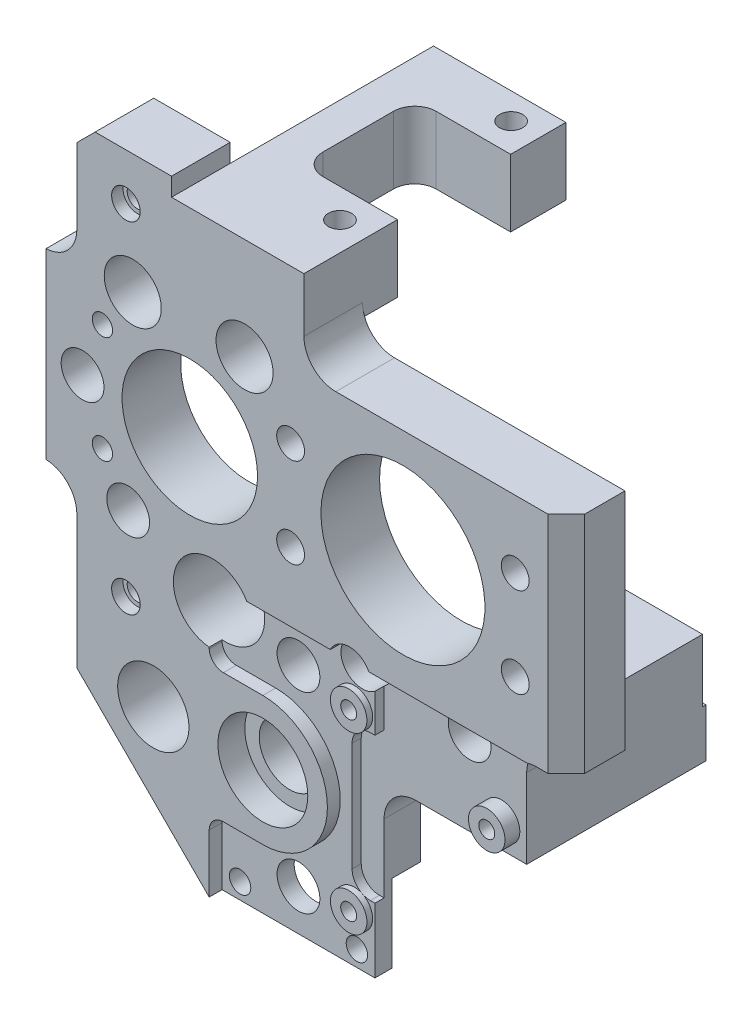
SolidWorks part; units mm, degrees
ref_plane "Front" through (0, 0, 0) normal (0, 0, 1) x (1, 0, 0)
ref_plane "Top" through (0, 0, 0) normal (0, 1, 0) x (1, 0, 0)
ref_plane "Right" through (0, 0, 0) normal (1, 0, 0) x (0, 0, -1)
sketch "Sketch1" plane through (0, 0, 0) normal (0, 0, 1) x (1, 0, 0)
  line L1 (-25.4, 24.13) -> (32.512, 24.13)
  line L2 (-25.4, 24.13) -> (-25.4, -43.274)
  line L3 (-25.4, -43.274) -> (32.512, -43.274)
  line L4 (32.512, 24.13) -> (32.512, -43.274)
  dimension "D1" = 24.13
  dimension "D2" = 67.404
  dimension "D3" = 25.4
  dimension "D4" = 57.912
extrude "Extrude1" add sketch "Sketch1" along normal blind 6.5278
sketch "Sketch2" plane through (0, 0, 6.5278) normal (0, 0, 1) x (1, 0, 0)
  circle A0 centre (-16.51, 18.9414) radius 1
  dimension "D1" = 16.51
  dimension "D2" = 2
  dimension "D3" = 18.9414
extrude "Cut-Extrude1" [suppressed] cut sketch "Sketch2" against normal through all
mirror "Mirror1" [suppressed] about plane through (0, 0, 0) normal (0, 1, 0)
sketch "Sketch3" plane through (0, 0, 0) normal (0, 0, -1) x (-1, 0, 0)
  line L1 (-32.512, -12.5) -> (-25.654, -12.5)
  line L2 (-32.512, -12.5) -> (-32.512, -43.274)
  line L3 (-32.512, -43.274) -> (-9.779, -43.274)
  line L4 (-25.654, -12.5) -> (-25.654, -24.892)
  line L5 (25.4, -43.274) -> (-32.512, -43.274) construction
  line L7 (-25.654, -24.892) -> (-9.779, -24.892)
  line L8 (-9.779, -24.892) -> (-9.779, -43.274)
  dimension "D1" = 9.779
  dimension "D2" = 25.654
  dimension "D3" = 24.892
  dimension "D4" = 22.733
  dimension "D5" = 30.774
extrude "Cut-Extrude2" cut sketch "Sketch3" against normal through all
sketch "Sketch4" plane through (0, 0, 0) normal (0, 0, -1) x (-1, 0, 0)
  line L0 (-9.779, -24.892) -> (-25.654, -24.892) construction
  line L1 (-25.654, -24.892) -> (-15.113, -24.892)
  line L2 (-25.654, -24.892) -> (-25.654, -12.5)
  line L3 (-25.654, -12.5) -> (-15.113, -12.5)
  line L4 (-15.113, -24.892) -> (-15.113, -12.5)
  line L5 (-25.654, -24.892) -> (-25.654, -12.5) construction
  line L6 (-25.654, -12.5) -> (-32.512, -12.5) construction
  dimension "D1" = 10.541
extrude "Extrude2" add sketch "Sketch4" along normal blind 15.492
sketch "Sketch5" plane through (0, 0, 0) normal (0, 0, 1) x (1, 0, 0)
  line L1 (32.512, 24.13) -> (3.302, 24.13)
  line L2 (32.512, 24.13) -> (32.512, 22.098)
  line L3 (32.512, 22.098) -> (3.302, 22.098)
  line L4 (3.302, 24.13) -> (3.302, 22.098)
  dimension "D1" = 2.032
  dimension "D2" = 29.21
extrude "Cut-Extrude3" cut sketch "Sketch5" along normal through all
hole_wizard "M8x0.75 Tapped Hole1" positions "Sketch9" profile "Sketch8" tap size "M8x1.25" standard "Ansi Metric"
sketch "Sketch9" plane through (0, 0, 6.5278) normal (0, 0, 1) x (1, 0, 0)
  line L0 (-25.4, 24.13) -> (-25.4, -43.274) construction
  point P0 (-1.27, -28.034)
  dimension "D1" = 24.13
  dimension "D2" = 28.034
sketch "Sketch8" plane through (-1.27, -28.034, 6.5278) normal (1, 0, 0) x (0, -1, 0)
  line L0 (0, 0) -> (0, 22.0198)
  line L1 (0, 22.0198) -> (3.4, 22.0198)
  line L2 (3.4, 22.0198) -> (3.4, 0)
  line L5 (3.4, 0) -> (0, 0)
  line L11 (0, -6.35) -> (0, 107.95) construction
  dimension "Thru Tap Drill Dia." = 6.8
  dimension "Thru Tap Drill Depth" = 22.0198
sketch "Sketch11" plane through (0, 0, 6.5278) normal (0, 0, 1) x (1, 0, 0)
  circle A0 centre (-1.27, -28.034) radius 5.0038
  circle A1 centre (-1.27, -28.034) radius 3.4 construction
  dimension "D1" = 10.0076
extrude "Cut-Extrude5" cut sketch "Sketch11" against normal blind 2.9972
sketch "Sketch12" plane through (0, 0, 0) normal (0, 0, -1) x (-1, 0, 0)
  line L1 (-32.512, 22.098) -> (-3.302, 22.098)
  line L2 (-32.512, 22.098) -> (-32.512, 12.5)
  line L3 (-32.512, 12.5) -> (-3.302, 12.5)
  line L4 (-3.302, 22.098) -> (-3.302, 12.5)
  line L5 (-3.302, 24.13) -> (-3.302, 22.098) construction
  dimension "D1" = 9.598
extrude "Cut-Extrude6" cut sketch "Sketch12" against normal through all
sketch "Sketch13" plane through (0, 0, 0) normal (0, 0, -1) x (-1, 0, 0)
  line L0 (-3.302, 24.13) -> (25.4, 24.13) construction
  line L1 (6.35, 24.13) -> (11.43, 24.13)
  line L2 (6.35, 24.13) -> (6.35, 14.605)
  line L3 (6.35, 14.605) -> (11.43, 14.605)
  line L4 (11.43, 24.13) -> (11.43, 14.605)
  line L5 (25.4, 24.13) -> (25.4, -43.274) construction
  dimension "D1" = 13.97
  dimension "D2" = 9.525
  dimension "D3" = 5.08
extrude "Extrude3" add sketch "Sketch13" along normal blind 22.6314
sketch "Sketch14" plane through (-6.35, 0, 0) normal (1, 0, 0) x (0, 0, -1)
  line L1 (0, 14.605) -> (3.8862, 14.605)
  line L2 (0, 14.605) -> (0, 22.098)
  line L3 (0, 22.098) -> (3.8862, 22.098)
  line L4 (3.8862, 14.605) -> (3.8862, 22.098)
  dimension "D1" = 3.8862
  dimension "D2" = 7.493
extrude "Extrude4" add sketch "Sketch14" along normal up to surface (9.652 mm away)
sketch "Sketch15" plane through (-6.35, 0, 0) normal (1, 0, 0) x (0, 0, -1)
  line L1 (22.6314, 14.605) -> (16.4846, 14.605)
  line L2 (22.6314, 14.605) -> (22.6314, 22.098)
  line L3 (22.6314, 22.098) -> (16.4846, 22.098)
  line L4 (16.4846, 14.605) -> (16.4846, 22.098)
  dimension "D1" = 6.1468
  dimension "D2" = 7.493
extrude "Extrude5" add sketch "Sketch15" along normal up to surface (9.652 mm away)
fillet "Fillet1" radius 2.54 2 edges at (-6.35, 18.3515, -3.8862) (-6.35, 18.3515, -16.4846)
sketch "Sketch16" plane through (0, 24.13, 0) normal (0, 1, 0) x (-1, 0, 0)
  line L1 (-3.302, 6.5278) -> (6.35, 6.5278)
  line L2 (-3.302, 6.5278) -> (-3.302, 0)
  line L3 (-3.302, 0) -> (6.35, 0)
  line L4 (6.35, 6.5278) -> (6.35, 0)
extrude "Cut-Extrude7" cut sketch "Sketch16" against normal up to surface (2.032 mm away)
sketch "Sketch18" [suppressed] plane through (0, 0, 0) normal (0, 0, -1) x (-1, 0, 0)
  circle A0 centre (16.51, -18.9414) radius 3.9688
  circle A1 centre (16.51, -18.9414) radius 1 construction
  dimension "D1" = 7.9375
extrude "Cut-Extrude9" [suppressed] cut sketch "Sketch18" against normal offset from surface (4.8006 mm away) 1.7272
mirror "Mirror2" [suppressed] about plane through (0, 0, 0) normal (0, 1, 0)
sketch "Sketch19" plane through (0, 0, -15.492) normal (0, 0, -1) x (-1, 0, 0)
  line L0 (-15.113, -24.892) -> (-15.113, -12.5) construction
  line L1 (-25.654, -24.892) -> (-15.113, -24.892)
  line L2 (-25.654, -24.892) -> (-25.654, -19.485)
  line L3 (-25.654, -19.485) -> (-15.113, -19.485)
  line L4 (-15.113, -24.892) -> (-15.113, -19.485)
  line L5 (-15.113, -12.5) -> (-25.654, -12.5) construction
  dimension "D1" = 6.985
extrude "Extrude6" add sketch "Sketch19" along normal blind 0.381
hole_wizard "3/32 (0.09375) Diameter Hole1" positions "Sketch21" profile "Sketch20" hole size "3/32" standard "Ansi Inch"
sketch "Sketch21" plane through (0, 0, -15.873) normal (0, 0, -1) x (-1, 0, 0)
  line L0 (-25.654, -24.892) -> (-15.113, -24.892) construction
  line L1 (-25.654, -19.485) -> (-25.654, -24.892) construction
  point P0 (-23.368, -21.9436)
  dimension "D1" = 2.9484
  dimension "D2" = 2.286
sketch "Sketch20" plane through (23.368, -21.9436, -15.873) normal (1, 0, 0) x (0, 1, 0)
  line L0 (0, 0) -> (0, 5.715)
  line L1 (0, 5.715) -> (1.1906, 5.715)
  line L2 (1.1906, 5.715) -> (1.1906, 0)
  line L5 (1.1906, 0) -> (0, 0)
  line L10 (0, 5.715) -> (-1.1906, 5.715) construction
  line L11 (0, -6.35) -> (0, 107.95) construction
  dimension "Hole Dia." = 2.3812
  dimension "Hole Depth" = 5.715
  dimension "Drill Angle" = 180
hole_wizard "#4-40 Tapped Hole1" positions "Sketch23" profile "Sketch22" tap size "#4-40" standard "Ansi Inch"
sketch "Sketch23" plane through (0, 0, -15.873) normal (0, 0, -1) x (-1, 0, 0)
  line L0 (-25.654, -19.485) -> (-25.654, -24.892) construction
  line L1 (-25.654, -24.892) -> (-15.113, -24.892) construction
  point P0 (-18.161, -21.9436)
  dimension "D1" = 7.493
  dimension "D2" = 2.9484
sketch "Sketch22" plane through (18.161, -21.9436, -15.873) normal (1, 0, 0) x (0, 1, 0)
  line L0 (0, 0) -> (0, 12.2362)
  line L1 (0, 12.2362) -> (1.1303, 11.557)
  line L2 (1.1303, 11.557) -> (1.1303, 0)
  line L5 (1.1303, 0) -> (0, 0)
  line L10 (0, 12.2362) -> (-1.1303, 11.557) construction
  line L11 (0, -6.35) -> (0, 107.95) construction
  dimension "Tap Drill Dia." = 2.2606
  dimension "Tap Drill Depth" = 11.557
  dimension "Drill Angle" = 118
hole_wizard "#5-40 Tapped Hole1" positions "Sketch25" profile "Sketch24" tap size "#5-40" standard "Ansi Inch"
sketch "Sketch25" plane through (0, 22.098, 0) normal (0, 1, 0) x (-1, 0, 0)
  line L0 (-3.302, -3.8862) -> (-3.302, 6.5278) construction
  line L1 (-3.302, -22.6314) -> (-3.302, -16.4846) construction
  line L2 (6.35, 6.5278) -> (-3.302, 6.5278) construction
  point P0 (-0.127, -0.6604)
  point P1 (-0.127, -19.7104)
  dimension "D1" = 3.175
  dimension "D2" = 3.175
  dimension "D3" = 7.1882
  dimension "D4" = 19.05
sketch "Sketch24" plane through (0.127, 22.098, -0.6604) normal (1, 0, 0) x (0, 0, 1)
  line L0 (0, 0) -> (0, 9.0295)
  line L1 (0, 9.0295) -> (1.289, 8.255)
  line L2 (1.289, 8.255) -> (1.289, 0)
  line L5 (1.289, 0) -> (0, 0)
  line L10 (0, 9.0295) -> (-1.2891, 8.255) construction
  line L11 (0, -6.35) -> (0, 107.95) construction
  dimension "Tap Drill Dia." = 2.5781
  dimension "Tap Drill Depth" = 8.255
  dimension "Drill Angle" = 118
hole_wizard "M3.1 (3.1) Diameter Hole1" positions "Sketch27" profile "Sketch26" hole size "M3.1" standard "Ansi Metric"
sketch "Sketch27" plane through (0, 0, 6.5278) normal (0, 0, 1) x (1, 0, 0)
  line L0 (32.512, -12.5) -> (32.512, 12.5) construction
  line L1 (32.512, 12.5) -> (3.302, 12.5) construction
  point P0 (26.823, -5)
  point P1 (1.823, 5)
  point P2 (1.823, -5)
  point P3 (26.823, 5)
  dimension "D1" = 5.689
  dimension "D2" = 25
  dimension "D3" = 10
  dimension "D4" = 7.5
  dimension "D5" = 25
  dimension "D6" = 10
  dimension "D7" = 5.689
  dimension "D8" = 7.5
sketch "Sketch26" plane through (26.823, -5, 6.5278) normal (1, 0, 0) x (0, -1, 0)
  line L0 (0, 0) -> (0, 29.1592)
  line L1 (0, 29.1592) -> (1.55, 29.1592)
  line L2 (1.55, 29.1592) -> (1.55, 0)
  line L5 (1.55, 0) -> (0, 0)
  line L11 (0, -6.35) -> (0, 107.95) construction
  dimension "Thru Hole Dia." = 3.1
  dimension "Thru Hole Depth" = 29.1592
hole_wizard "#4-40 Tapped Hole2" positions "Sketch29" profile "Sketch28" tap size "#4-40" standard "Ansi Inch"
sketch "Sketch29" plane through (0, 0, 6.5278) normal (0, 0, 1) x (1, 0, 0)
  point P0 (-19.1232, -5.969)
  point P1 (-19.1232, 5.969)
  dimension "D1" = 5.969
  dimension "D2" = 5.969
  dimension "D3" = 19.1232
sketch "Sketch28" plane through (-19.1232, -5.969, 6.5278) normal (1, 0, 0) x (0, -1, 0)
  line L0 (0, 0) -> (0, 29.1592)
  line L1 (0, 29.1592) -> (1.1303, 29.1592)
  line L2 (1.1303, 29.1592) -> (1.1303, 0)
  line L5 (1.1303, 0) -> (0, 0)
  line L11 (0, -6.35) -> (0, 107.95) construction
  dimension "Thru Tap Drill Dia." = 2.2606
  dimension "Thru Tap Drill Depth" = 29.1592
sketch "Sketch17" plane through (0, 0, 6.5278) normal (0, 0, 1) x (1, 0, 0)
  line L0 (32.512, -12.5) -> (32.512, 12.5) construction
  line L1 (-4.699, -12.667) -> (32.512, -12.667)
  line L2 (-7.239, -15.207) -> (-7.239, -43.274)
  line L3 (-7.239, -43.274) -> (32.512, -43.274)
  line L4 (32.512, -12.667) -> (32.512, -43.274)
  line L5 (-25.4, -43.274) -> (9.779, -43.274) construction
  arc A0 (-4.699, -12.667) -> (-7.239, -15.207) centre (-4.699, -15.207) ccw
  dimension "D1" = 2.54
  dimension "D3" = 39.751
  dimension "D2" = 30.607
extrude "Cut-Extrude8" cut sketch "Sketch17" against normal blind 0.7937
sketch "Sketch45" plane through (0, 0, 0) normal (0, 0, -1) x (-1, 0, 0)
  line L1 (25.4, -43.274) -> (21.971, -43.274)
  line L2 (25.4, -43.274) -> (25.4, -10.16)
  line L3 (25.4, -10.16) -> (21.971, -10.16)
  line L4 (21.971, -43.274) -> (21.971, -10.16)
  line L5 (25.4, 24.13) -> (21.971, 24.13)
  line L6 (25.4, 24.13) -> (25.4, 10.16)
  line L7 (25.4, 10.16) -> (21.971, 10.16)
  line L8 (21.971, 24.13) -> (21.971, 10.16)
  dimension "D1" = 3.429
  dimension "D2" = 33.114
  dimension "D3" = 13.97
extrude "Cut-Extrude13" cut sketch "Sketch45" against normal through all
chamfer "Chamfer1" distance 14.732 angle 45 1 edges at (-21.971, -43.274, 3.2639)
sketch "Sketch30" plane through (0, 0, 0) normal (0, 0, -1) x (-1, 0, 0)
  line L1 (-9.779, -43.274) -> (21.971, -43.274)
  line L2 (-9.779, -43.274) -> (-9.779, -34.6202)
  line L3 (-9.779, -34.6202) -> (21.971, -34.6202)
  line L4 (21.971, -43.274) -> (21.971, -34.6202)
extrude "Cut-Extrude10" cut sketch "Sketch30" against normal offset from surface (3.194 mm away) 2.54
hole_wizard "#2-56 Tapped Hole1" positions "Sketch32" profile "Sketch31" tap size "#2-56" standard "Ansi Inch"
sketch "Sketch32" plane through (0, 0, 5.734) normal (0, 0, 1) x (1, 0, 0)
  line L0 (9.779, -43.274) -> (9.779, -24.892) construction
  line L1 (-7.239, -43.274) -> (9.779, -43.274) construction
  line L2 (25.654, -12.667) -> (-4.699, -12.667) construction
  point P0 (7.493, -37.686)
  point P1 (7.493, -18.255)
  dimension "D1" = 2.286
  dimension "D2" = 5.588
  dimension "D3" = 5.588
sketch "Sketch31" plane through (7.493, -37.686, 5.734) normal (1, 0, 0) x (0, -1, 0)
  line L0 (0, 0) -> (0, 28.3655)
  line L1 (0, 28.3655) -> (0.889, 28.3655)
  line L2 (0.889, 28.3655) -> (0.889, 0)
  line L5 (0.889, 0) -> (0, 0)
  line L11 (0, -6.35) -> (0, 107.95) construction
  dimension "Thru Tap Drill Dia." = 1.778
  dimension "Thru Tap Drill Depth" = 28.3655
chamfer "Chamfer3" distance 2.032 angle 45 1 edges at (32.512, 0, 6.5278)
hole_wizard "#2-56 Tapped Hole2" positions "Sketch42" profile "Sketch41" tap size "#2-56" standard "Ansi Inch"
sketch "Sketch42" plane through (0, 0, 5.734) normal (0, 0, 1) x (1, 0, 0)
  line L1 (9.779, -24.892) -> (25.654, -24.892) construction
  point P0 (22.86, -22.098)
  dimension "D1" = 22.86
  dimension "D2" = 2.794
sketch "Sketch41" plane through (22.86, -22.098, 5.734) normal (1, 0, 0) x (0, -1, 0)
  line L0 (0, 0) -> (0, 9.0101)
  line L1 (0, 9.0101) -> (0.889, 8.476)
  line L2 (0.889, 8.476) -> (0.889, 0)
  line L5 (0.889, 0) -> (0, 0)
  line L10 (0, 9.0101) -> (-0.889, 8.476) construction
  line L11 (0, -6.35) -> (0, 107.95) construction
  dimension "Tap Drill Dia." = 1.778
  dimension "Tap Drill Depth" = 8.476
  dimension "Drill Angle" = 118
sketch "Sketch44" plane through (0, 0, 5.734) normal (0, 0, 1) x (1, 0, 0)
  line L0 (32.512, 12.5) -> (32.512, -12.5) construction
  line L1 (25.654, -12.667) -> (-4.699, -12.667) construction
  line L2 (-7.239, -15.207) -> (-7.239, -43.274) construction
  line L4 (32.512, -12.667) -> (-4.699, -12.667)
  line L5 (-7.239, -15.207) -> (-7.239, -43.274)
  line L8 (32.512, -12.667) -> (32.512, -43.274)
  line L11 (-7.239, -43.274) -> (32.512, -43.274)
  line L12 (-7.239, -43.274) -> (9.779, -43.274) construction
  circle A0 centre (7.493, -18.255) radius 2.032
  circle A1 centre (7.493, -37.686) radius 2.032
  circle A2 centre (22.86, -22.098) radius 2.032
  arc A3 (-4.699, -12.667) -> (-7.239, -15.207) centre (-4.699, -15.207) ccw construction
  circle A5 centre (7.493, -37.686) radius 0.889 construction
  circle A6 centre (7.493, -18.255) radius 0.889 construction
  circle A8 centre (22.86, -22.098) radius 0.889 construction
  arc A9 (-7.239, -15.207) -> (-4.699, -12.667) centre (-4.699, -15.207) cw
  dimension "D1" = 4.064
extrude "Cut-Extrude12" cut sketch "Sketch44" against normal blind 0.635 and the other way through all
fillet "Fillet2" radius 3.556 5 edges at (3.302, 12.5, 3.2639) (25.654, -12.5, 3.2639) (9.779, -24.892, 2.5495) (-21.971, 10.16, 3.2639) (-21.971, -10.16, 3.2639)
chamfer "Chamfer2" distance 2.032 angle 45 1 edges at (-21.971, 24.13, 3.2639)
hole_wizard "23/32 (0.71875) Diameter Hole1" positions "Sketch47" profile "Sketch46" hole size "23/32" standard "Ansi Inch"
sketch "Sketch47" plane through (0, 0, 0) normal (0, 0, -1) x (-1, 0, 0)
  line L0 (-1.823, -5) -> (-26.823, -5) construction
  circle A0 centre (-1.823, -5) radius 1.55 construction
  circle A1 centre (-26.823, -5) radius 1.55 construction
  point P0 (-14.323, 0)
  point P7 (-14.323, -5)
sketch "Sketch46" plane through (14.323, 0, 0) normal (1, 0, 0) x (0, 1, 0)
  line L0 (0, 0) -> (0, 6.5278)
  line L1 (0, 6.5278) -> (9.1281, 6.5278)
  line L2 (9.1281, 6.5278) -> (9.1281, 0)
  line L5 (9.1281, 0) -> (0, 0)
  line L11 (0, -6.35) -> (0, 107.95) construction
  dimension "Thru Hole Dia." = 18.2562
  dimension "Thru Hole Depth" = 6.5278
hole_wizard "19/32 (0.59375) Diameter Hole1" positions "Sketch36" profile "Sketch35" hole size "19/32" standard "Ansi Inch"
sketch "Sketch36" plane through (0, 0, 6.5278) normal (0, 0, 1) x (1, 0, 0)
  line L0 (-25.4, 10.16) -> (-25.4, -10.16) construction
  point P1 (-9.398, 0)
  dimension "D1" = 16.002
sketch "Sketch35" plane through (-9.398, 0, 6.5278) normal (1, 0, 0) x (0, -1, 0)
  line L0 (0, 0) -> (0, 29.1592)
  line L1 (0, 29.1592) -> (7.5406, 29.1592)
  line L2 (7.5406, 29.1592) -> (7.5406, 0)
  line L5 (7.5406, 0) -> (0, 0)
  line L11 (0, -6.35) -> (0, 107.95) construction
  dimension "Thru Hole Dia." = 15.0812
  dimension "Thru Hole Depth" = 29.1592
hole_wizard "11/32 (0.34375) Diameter Hole1" positions "Sketch49" profile "Sketch48" hole size "11/32" standard "Ansi Inch"
sketch "Sketch49" plane through (0, 0, 0) normal (0, 0, -1) x (-1, 0, 0)
  line L0 (25.4, 10.16) -> (25.4, -10.16) construction
  line L1 (-9.779, -43.274) -> (7.239, -43.274) construction
  point P0 (6.858, -14.826)
  dimension "D1" = 18.542
  dimension "D2" = 28.448
sketch "Sketch48" plane through (-6.858, -14.826, 0) normal (1, 0, 0) x (0, 1, 0)
  line L0 (0, 0) -> (0, 6.5278)
  line L1 (0, 6.5278) -> (4.3656, 6.5278)
  line L2 (4.3656, 6.5278) -> (4.3656, 0)
  line L5 (4.3656, 0) -> (0, 0)
  line L11 (0, -6.35) -> (0, 107.95) construction
  dimension "Thru Hole Dia." = 8.7312
  dimension "Thru Hole Depth" = 6.5278
hole_wizard "5/16 (0.3125) Diameter Hole1" positions "Sketch51" profile "Sketch50" hole size "5/16" standard "Ansi Inch"
sketch "Sketch51" plane through (0, 0, 0) normal (0, 0, -1) x (-1, 0, 0)
  line L0 (25.4, 10.16) -> (25.4, -10.16) construction
  line L1 (-9.779, -43.274) -> (7.239, -43.274) construction
  point P0 (13.462, -28.034)
  dimension "D1" = 11.938
  dimension "D2" = 15.24
sketch "Sketch50" plane through (-13.462, -28.034, 0) normal (1, 0, 0) x (0, 1, 0)
  line L0 (0, 0) -> (0, 6.5278)
  line L1 (0, 6.5278) -> (3.9687, 6.5278)
  line L2 (3.9687, 6.5278) -> (3.9687, 0)
  line L5 (3.9687, 0) -> (0, 0)
  line L11 (0, -6.35) -> (0, 107.95) construction
  dimension "Thru Hole Dia." = 7.9375
  dimension "Thru Hole Depth" = 6.5278
hole_wizard "1/4 (0.25) Diameter Hole1" positions "Sketch40" profile "Sketch39" hole size "1/4" standard "Ansi Inch"
sketch "Sketch40" plane through (0, 0, 0) normal (0, 0, -1) x (-1, 0, 0)
  line L0 (25.4, 10.16) -> (25.4, -10.16) construction
  line L2 (11.43, 24.13) -> (19.939, 24.13) construction
  line L3 (6.35, 24.13) -> (11.43, 24.13) construction
  point P2 (15.748, 10.795)
  point P10 (3.302, 10.795)
  dimension "D2" = 9.652
  dimension "D6" = 13.335
  dimension "D7" = 13.335
  dimension "D8" = 22.098
sketch "Sketch39" plane through (-15.748, 10.795, 0) normal (1, 0, 0) x (0, 1, 0)
  line L0 (0, 0) -> (0, 6.5278)
  line L1 (0, 6.5278) -> (3.175, 6.5278)
  line L2 (3.175, 6.5278) -> (3.175, 0)
  line L5 (3.175, 0) -> (0, 0)
  line L11 (0, -6.35) -> (0, 107.95) construction
  dimension "Thru Hole Dia." = 6.35
  dimension "Thru Hole Depth" = 6.5278
hole_wizard "3/16 (0.1875) Diameter Hole1" positions "Sketch34" profile "Sketch33" hole size "3/16" standard "Ansi Inch"
sketch "Sketch34" plane through (0, 0, 6.5278) normal (0, 0, 1) x (1, 0, 0)
  line L0 (-25.4, 10.16) -> (-25.4, -10.16) construction
  line L1 (-7.239, -43.274) -> (9.779, -43.274) construction
  line L2 (-25.4, 10.16) -> (-25.4, -10.16) construction
  line L3 (-7.239, -43.274) -> (9.779, -43.274) construction
  line L7 (-6.35, 24.13) -> (-19.939, 24.13) construction
  line L10 (-25.4, 10.16) -> (-25.4, -10.16) construction
  point P0 (8.382, -13.716)
  point P1 (1.27, -17.366)
  point P3 (-16.256, -10.508)
  point P6 (1.27, -38.702)
  point P23 (-21.336, 0)
  dimension "D2" = 33.782
  dimension "D3" = 9.144
  dimension "D4" = 32.766
  dimension "D5" = 26.67
  dimension "D6" = 4.572
  dimension "D8" = 26.67
  dimension "D9" = 25.908
  dimension "D10" = 37.846
  dimension "D14" = 4.064
sketch "Sketch33" plane through (8.382, -13.716, 6.5278) normal (1, 0, 0) x (0, -1, 0)
  line L0 (0, 0) -> (0, 29.1592)
  line L1 (0, 29.1592) -> (2.3812, 29.1592)
  line L2 (2.3812, 29.1592) -> (2.3812, 0)
  line L5 (2.3812, 0) -> (0, 0)
  line L11 (0, -6.35) -> (0, 107.95) construction
  dimension "Thru Hole Dia." = 4.7625
  dimension "Thru Hole Depth" = 29.1592
sketch "Sketch52" plane through (0, 0, -22.6314) normal (0, 0, -1) x (-1, 0, 0)
  line L0 (-3.302, 14.605) -> (-3.302, 22.098) construction
  line L1 (-3.302, 9.828) -> (-12.1944, 9.828)
  line L2 (-3.302, 9.828) -> (-3.302, 25.581)
  line L3 (-3.302, 25.581) -> (-12.1944, 25.581)
  line L4 (-12.1944, 9.828) -> (-12.1944, 25.581)
extrude "Cut-Extrude14" cut sketch "Sketch52" against normal up to surface (22.6314 mm away)
sketch "Sketch53" plane through (0, 24.13, 0) normal (0, 1, 0) x (-1, 0, 0)
  line L0 (6.35, 6.5278) -> (19.939, 6.5278) construction
  line L1 (6.35, -22.6314) -> (11.43, -22.6314)
  line L2 (6.35, -22.6314) -> (6.35, 6.5278)
  line L3 (6.35, 6.5278) -> (11.43, 6.5278)
  line L4 (11.43, -22.6314) -> (11.43, 6.5278)
  line L5 (11.43, -22.6314) -> (11.43, 0) construction
extrude "Cut-Extrude15" cut sketch "Sketch53" against normal up to surface (2.032 mm away)
hole_wizard "3/16 (0.1875) Diameter Hole2" positions "Sketch55" profile "Sketch54" hole size "3/16" standard "Ansi Inch"
sketch "Sketch55" plane through (0, 0, 5.0991) normal (0, 0, 1) x (1, 0, 0)
  line L0 (-25.4, 10.16) -> (-25.4, -10.16) construction
  line L2 (-7.239, -43.274) -> (9.779, -43.274) construction
  point P0 (19.304, -15.588)
  dimension "D1" = 44.704
  dimension "D2" = 27.686
sketch "Sketch54" plane through (19.304, -15.588, 5.0991) normal (1, 0, 0) x (0, -1, 0)
  line L0 (0, 0) -> (0, 17.78)
  line L1 (0, 17.78) -> (2.3812, 17.78)
  line L2 (2.3812, 17.78) -> (2.3812, 0)
  line L5 (2.3812, 0) -> (0, 0)
  line L10 (0, 17.78) -> (-2.3812, 17.78) construction
  line L11 (0, -6.35) -> (0, 107.95) construction
  dimension "Hole Dia." = 4.7625
  dimension "Hole Depth" = 17.78
  dimension "Drill Angle" = 180
sketch "Sketch56" plane through (0, 0, 5.0991) normal (0, 0, 1) x (1, 0, 0)
  line L1 (35.1814, -31.5182) -> (9.779, -31.5182)
  line L2 (35.1814, -31.5182) -> (35.1814, -12.667)
  line L3 (35.1814, -12.667) -> (9.779, -12.667)
  line L4 (9.779, -31.5182) -> (9.779, -12.667)
  line L5 (28.1331, -12.667) -> (10.5197, -12.667) construction
  line L7 (9.779, -28.448) -> (9.779, -43.274) construction
  circle A0 centre (22.86, -22.098) radius 2.032
  circle A1 centre (22.86, -22.098) radius 2.032 construction
extrude "Cut-Extrude16" cut sketch "Sketch56" against normal blind 1.016
sketch "Sketch57" plane through (0, 0, 6.5278) normal (0, 0, 1) x (1, 0, 0)
  circle A1 centre (-5.23, -41.496) radius 1.1906
  circle A2 centre (7.77, -41.496) radius 1.1906
  dimension "D1" = 2.3813
  dimension "D3" = 13
  dimension "D2" = 5.23
  dimension "D4" = 41.496
  dimension "D5" = 41.496
extrude "Cut-Extrude18" cut sketch "Sketch57" against normal through all
sketch "Sketch58" plane through (0, 0, 6.5278) normal (0, 0, 1) x (1, 0, 0)
  line L0 (-11.43, 24.13) -> (-19.939, 24.13) construction
  line L1 (-25.4, 10.16) -> (-25.4, -10.16) construction
  circle A0 centre (-16.51, 18.9414) radius 1.6002
  dimension "D1" = 3.2004
  dimension "D2" = 5.1886
  dimension "D3" = 8.89
extrude "Extrude7" add sketch "Sketch58" along normal blind 0.0003
mirror "Mirror3" about plane through (0, 0, 0) normal (0, 1, 0) of "Extrude7"
sketch "Sketch59" plane through (0, 0, 5.0991) normal (0, 0, 1) x (1, 0, 0)
  line L0 (9.779, -15.6444) -> (9.779, -43.274) construction
  line L1 (9.271, -36.0636) -> (9.779, -36.0636)
  line L2 (7.239, -34.0316) -> (7.239, -21.9094)
  line L3 (9.271, -19.8774) -> (9.779, -19.8774)
  line L4 (9.779, -36.0636) -> (9.779, -19.8774)
  arc A2 (7.239, -21.9094) -> (9.271, -19.8774) centre (9.271, -21.9094) cw
  arc A3 (9.271, -36.0636) -> (7.239, -34.0316) centre (9.271, -34.0316) cw
  circle A4 centre (7.493, -18.255) radius 2.032 construction
  circle A5 centre (7.493, -37.686) radius 2.032 construction
  dimension "D2" = 2.032
  dimension "D1" = 2.54
  dimension "D3" = 2.54
extrude "Cut-Extrude19" cut sketch "Sketch59" against normal up to surface (1.016 mm away)
hole_wizard "#4-40 Tapped Hole3" positions "3DSketch1" profile "Sketch60" tap size "#4-40" standard "Ansi Inch"
sketch3d "3DSketch1"
  line L0 (-16.51, 18.9414, 6.5281) -> (-16.51, 18.9414, 6.5278) construction
  line L1 (-16.51, -18.9414, 6.5281) -> (-16.51, -18.9414, 6.5278) construction
  point P0 (-16.51, 18.9414, 6.5281)
  point P4 (-16.51, -18.9414, 6.5281)
sketch "Sketch60" plane through (-16.51, 18.9414, 6.5281) normal (1, 0, 0) x (0, -1, 0)
  line L0 (0, 0) -> (0, 29.1595)
  line L1 (0, 29.1595) -> (1.1303, 29.1595)
  line L2 (1.1303, 29.1595) -> (1.1303, 0)
  line L5 (1.1303, 0) -> (0, 0)
  line L11 (0, -6.35) -> (0, 107.95) construction
  dimension "Thru Tap Drill Dia." = 2.2606
  dimension "Thru Tap Drill Depth" = 29.1595
sketch "Sketch61" plane through (0, 0, 6.5281) normal (0, 0, 1) x (1, 0, 0)
  circle A0 centre (-16.51, 18.9414) radius 1.0287
  circle A1 centre (-16.51, -18.9414) radius 1.0287
extrude "Cut-Extrude20" [suppressed] cut sketch "Sketch61" against normal blind 1.27
sketch "Sketch62" plane through (0, 0, 5.0991) normal (0, 0, 1) x (1, 0, 0)
  line L0 (-1.27, -20.8458) -> (-5.6537, -20.8458)
  line L2 (-1.27, -35.2222) -> (-5.6515, -35.2222)
  line L3 (-7.239, -19.1749) -> (-7.239, -43.274) construction
  line L4 (-7.239, -19.3416) -> (-7.239, -36.8097)
  circle A0 centre (-1.27, -28.034) radius 5.0038
  arc A1 (-1.27, -35.2222) -> (-1.27, -20.8458) centre (-1.27, -28.034) ccw
  arc A2 (-7.239, -19.3416) -> (-5.6537, -20.8458) centre (-5.6537, -19.2583) ccw
  arc A3 (-5.6515, -35.2222) -> (-7.239, -36.8097) centre (-5.6515, -36.8097) ccw
  dimension "D1" = 10.0076
  dimension "D2" = 14.3764
  dimension "D3" = 3.175
extrude "Extrude8" add sketch "Sketch62" along normal up to surface (1.4288 mm away)
sketch "Sketch63" plane through (0, 22.098, 0) normal (0, 1, 0) x (1, 0, 0)
  line L1 (3.302, 16.4846) -> (-4.9848, 16.4846)
  line L2 (3.302, 16.4846) -> (3.302, 3.8862)
  line L3 (3.302, 3.8862) -> (-4.9848, 3.8862)
  line L4 (-7.366, 14.1034) -> (-7.366, 6.2675)
  arc A0 (-4.9848, 16.4846) -> (-7.366, 14.1034) centre (-4.9848, 14.1034) ccw
  arc A1 (-4.9848, 3.8862) -> (-7.366, 6.2675) centre (-4.9848, 6.2675) cw
  dimension "D1" = 2.3813
  dimension "D2" = 10.668
  dimension "D3" = 12.5984
extrude "Extrude9" cut sketch "Sketch63" against normal up to next
sketch "Sketch65" plane through (0, 0, 6.5281) normal (0, 0, 1) x (1, 0, 0)
  circle A0 centre (-16.51, 18.9414) radius 1.5875
  dimension "D1" = 3.175
extrude "Extrude11" cut sketch "Sketch65" against normal blind 1.27
sketch "Sketch66" plane through (0, 0, 6.5281) normal (0, 0, 1) x (1, 0, 0)
  circle A0 centre (-16.51, -18.9414) radius 1.5875
  dimension "D1" = 3.175
extrude "Extrude12" cut sketch "Sketch66" against normal blind 1.27
